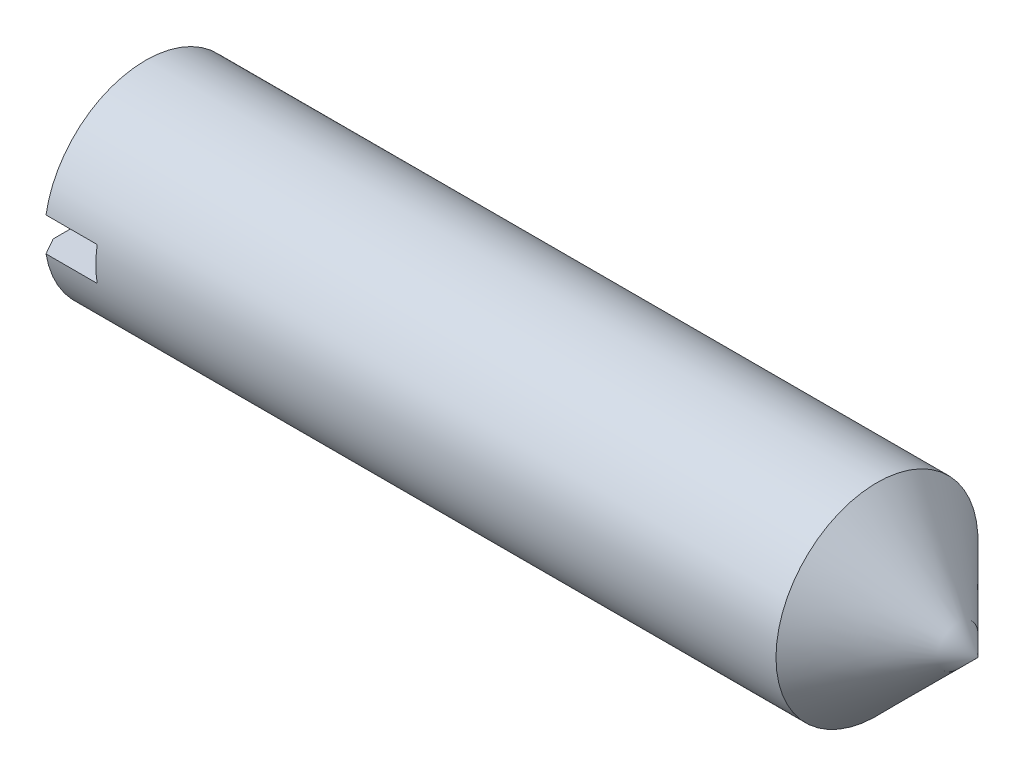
SolidWorks part; units mm, degrees
ref_plane "Plane1" through (0, 0, 0) normal (0, 0, 1) x (1, 0, 0)
ref_plane "Plane2" through (0, 0, 0) normal (0, 1, 0) x (1, 0, 0)
ref_plane "Plane3" through (0, 0, 0) normal (1, 0, 0) x (0, 0, -1)
sketch "BodySke" plane through (0, 0, 0) normal (0, 0, 1) x (1, 0, 0)
  line L0 (0, 0) -> (0, 5.036)
  line L1 (0, 5.036) -> (0.5566, 6)
  line L2 (0.5566, 6) -> (44, 6)
  line L3 (44, 6) -> (50, 0)
  line L4 (50, 0) -> (0, 0)
  line L5 (-12.7, 0) -> (88.9, 0) construction
  line L6 (44, -6) -> (50, 0) construction
  line L7 (0.875, 15.875) -> (0.875, -3.175) construction
  line L8 (0, -5.036) -> (0.5566, -6) construction
  dimension "Cone_ang" = 90
  dimension "Length" = 50
  dimension "Diameter" = 12
  dimension "Drive_ch_ang" = 60
  dimension "Minor_dia" = 10.072
  dimension "Advance" = 1.75
revolve "BaseBody" add sketch "BodySke"
extrude "Slot" cut sketch "Sketch2" against normal blind 3.6
sketch "Sketch2" plane through (0, 0, 0) normal (-1, 0, 0) x (0, 0, 1)
  line L0 (6, 1) -> (-6, 1)
  line L1 (6, -1) -> (6, 1)
  line L2 (-6, -1) -> (-6, 1)
  line L4 (6, -1) -> (-6, -1)
  circle A2 centre (0, 0) radius 6 construction
  dimension "D1" = 1
  dimension "Slot_width" = 2
sketch "ThdSchSke" plane through (0, 0, 0) normal (0, 0, 1) x (1, 0, 0)
  line L0 (0.5566, -5.036) -> (-0.1184, -6)
  line L1 (0.5566, -5.036) -> (1.2316, -6)
  line L2 (1.2316, -6) -> (1.2316, -7.5)
  line L3 (-3.175, 0) -> (5.1513, 0) construction
  line L4 (0.5566, 6) -> (0.5566, -6) construction
  line L5 (1.2316, -7.5) -> (-0.1184, -7.5)
  line L6 (-0.1184, -7.5) -> (-0.1184, -6)
  dimension "Thread_minor" = 10.072
  dimension "Diameter" = 12
  dimension "SideAngle" = 55
  dimension "VeeAngle" = 70
  dimension "Overcut" = 15
revolve "ThreadSchematic" [suppressed] cut sketch "ThdSchSke" angle 360 about L3
pattern_linear "ThdSchPat" [suppressed]
equation "\"Thread_minor@ThreadCosmetic\" = \"Minor_dia@BodySke\""
equation "\"Thread_minor@ThdSchSke\" = \"Thread_minor@ThreadCosmetic\""
equation "\"Diameter@ThdSchSke\" = \"Diameter@BodySke\""
equation "\"Overcut@ThdSchSke\" = \"Diameter@BodySke\" * 1.25"
equation "\"Num_threads@ThdSchPat\" = int( (\"Length@BodySke\" - ( ( ( \"Diameter@BodySke\" - \"Minor_dia@BodySke\" ) * 0.5 ) / tan( \"Drive_ch_ang@BodySke\" * 0.017453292 ) ) - ( ( \"Diameter@BodySke\" * 0.5 ) / tan( \"Con"
equation "\"Advance@ThdSchPat\" = (\"Length@BodySke\" - ( ( ( \"Diameter@BodySke\" - \"Minor_dia@BodySke\" ) * 0.5 ) / tan( \"Drive_ch_ang@BodySke\" * 0.017453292 ) ) - ( ( \"Diameter@BodySke\" * 0.5 ) / tan( \"Cone_ang@Bod"
equation "' \"Num_threads@ThdSchPat\" = \"Num_threads@ThdSchPat\" - sgn( \"Num_threads@ThdSchPat\" - 1) '---chamfered tips only---"
equation "\"D1@Sketch2\" = \"Slot_width@Sketch2\" / 2"
